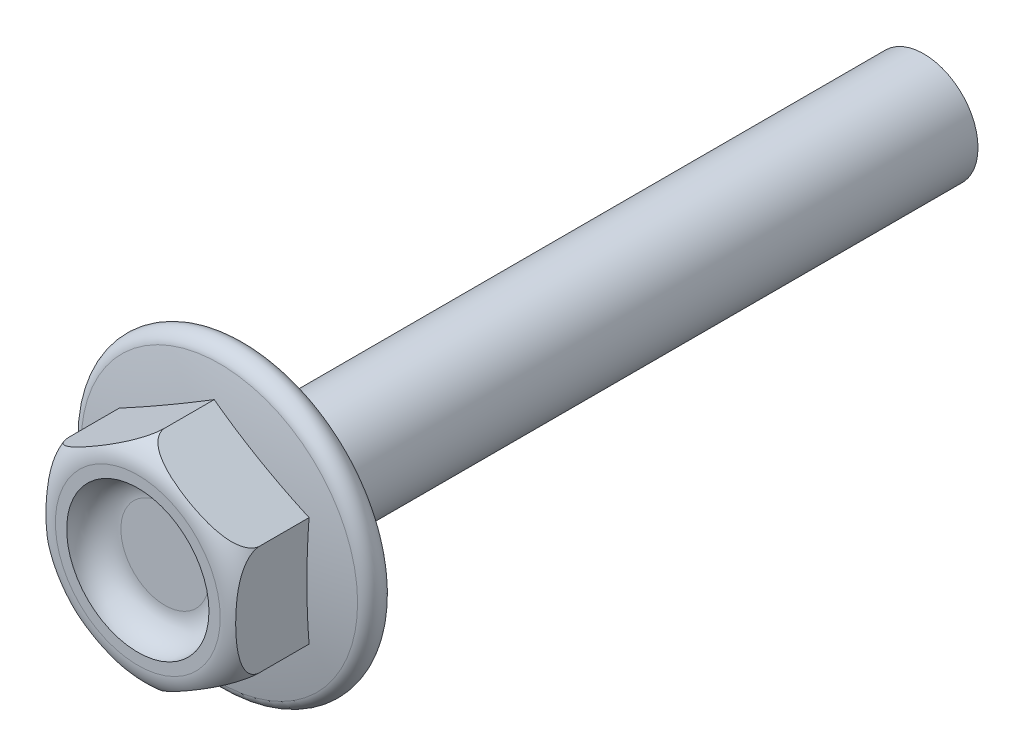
SolidWorks part; units mm, degrees
ref_plane "Plane1" through (0, 0, 0) normal (0, 0, 1) x (1, 0, 0)
ref_plane "Plane2" through (0, 0, 0) normal (0, 1, 0) x (-1, 0, 0)
ref_plane "Plane3" through (0, 0, 0) normal (1, 0, 0) x (0, 0, -1)
extrude "Shank" add sketch "Shank Sketch" against normal blind 25
sketch "Shank Sketch" plane through (0, 0, 0) normal (0, 0, 1) x (1, 0, 0)
  line L0 (50, 0) -> (-50, 0) construction
  line L1 (0, -50) -> (0, 50) construction
  circle A0 centre (0, 0) radius 2
  dimension "Shank diameter" = 4
extrude "Head" add sketch "Head Sketch" along normal blind 4
sketch "Head Sketch" plane through (0, 0, 0) normal (0, 0, 1) x (1, 0, 0)
  line L0 (0, 4.0415) -> (3.5, 2.0207)
  line L1 (3.5, 2.0207) -> (3.5, -2.0207)
  line L2 (3.5, -2.0207) -> (0, -4.0415)
  line L3 (0, -4.0415) -> (-3.5, -2.0207)
  line L4 (-3.5, -2.0207) -> (-3.5, 2.0207)
  line L5 (-3.5, 2.0207) -> (0, 4.0415)
  line L6 (3.5, 2.0207) -> (-3.5, -2.0207) construction
  line L7 (0, 4.0415) -> (0, -4.0415) construction
  line L8 (-3.5, 2.0207) -> (3.5, -2.0207) construction
  point P0 (0, 0)
  dimension "D1" = 60
  dimension "D2" = 60
  dimension "Width across flats" = 7
sketch "Sketch3" plane through (0, 0, 0) normal (0, 1, 0) x (-1, 0, 0)
  line L0 (0, 0) -> (0, 3) construction
  line L1 (0, -25) -> (0, 0) construction
  line L4 (-5, 0) -> (0, 0)
  line L5 (0, 0) -> (0, 1.5)
  arc A0 (0, 1.5) -> (-5.099, 0.9901) centre (0, -24.25) ccw
  arc A1 (-5, 0) -> (-5.099, 0.9901) centre (-5, 0.5) cw
  dimension "D1" = 0.5
  dimension "D2" = 10
  dimension "D3" = 1.5
revolve "Flange" add sketch "Sketch3" angle 360 about L0
sketch "Sketch5" plane through (0, 0, 0) normal (1, 0, 0) x (0, 0, -1)
  line L0 (-4, -3.0415) -> (-4, -4.0415)
  line L1 (-4, -4.0415) -> (-3, -4.0415)
  line L2 (-4, -4.0415) -> (-1.1809, -4.0415) construction
  line L3 (-4, -4.0415) -> (-4, -2.0207) construction
  line L5 (-15.0856, 0) -> (-8.1394, 0) construction
  line L6 (50, 0) -> (-50, 0) construction
  arc A0 (-4, -3.0415) -> (-3, -4.0415) centre (-3, -3.0415) ccw
  dimension "D1" = 1
revolve "Head Trim" cut sketch "Sketch5" angle 360 about L5
sketch "Sketch6" plane through (0, 0, 4) normal (0, 0, 1) x (1, 0, 0)
  circle A3 centre (0, 0) radius 2.625
  dimension "D1" = 5.25
extrude "Head Cut" cut sketch "Sketch6" against normal blind 1
fillet "Fillet1" radius 1 1 edges at (2.625, 0, 3)
equation "\"D1@Sketch6\" = \"Width across flats@Head Sketch\"*3/4"
